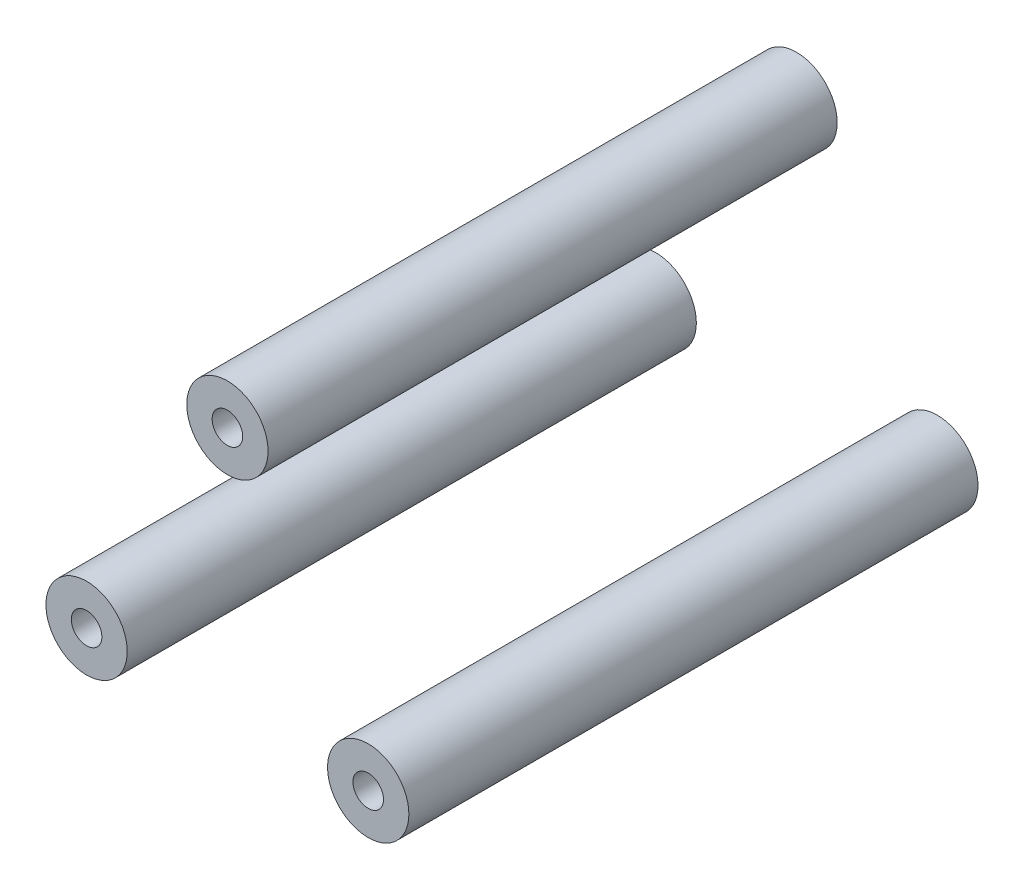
SolidWorks part; units mm, degrees
ref_plane "Front Plane" through (0, 0, 0) normal (0, 0, 1) x (1, 0, 0)
ref_plane "Top Plane" through (0, 0, 0) normal (0, 1, 0) x (1, 0, 0)
ref_plane "Right Plane" through (0, 0, 0) normal (1, 0, 0) x (0, 0, -1)
sketch "Sketch1" plane through (0, 0, 0) normal (0, 0, 1) x (1, 0, 0)
  line L0 (0, 0) -> (0, 25.4)
  line L1 (0, 0) -> (21.997, -12.7)
  line L2 (0, 0) -> (-21.997, -12.7)
  circle A0 centre (0, 25.4) radius 6.35
  circle A1 centre (0, 25.4) radius 2.3876
  circle A2 centre (-21.997, -12.7) radius 2.3876
  circle A3 centre (-21.997, -12.7) radius 6.35
  circle A4 centre (21.997, -12.7) radius 2.3876
  circle A5 centre (21.997, -12.7) radius 6.35
  dimension "D1" = 12.7
  dimension "D2" = 4.7752
  dimension "D3" = 120
  dimension "D4" = 120
  dimension "D5" = 25.4
sketch "Sketch2" plane through (0, 0, 0) normal (0, 0, 1) x (1, 0, 0)
  circle A0 centre (-21.997, -12.7) radius 6.35 construction
  circle A1 centre (21.997, -12.7) radius 6.35 construction
  circle A2 centre (21.997, -12.7) radius 2.3876 construction
  circle A3 centre (-21.997, -12.7) radius 2.3876 construction
  circle A4 centre (0, 25.4) radius 6.35 construction
  circle A5 centre (0, 25.4) radius 2.3876 construction
  circle A6 centre (-21.997, -12.7) radius 6.35
  circle A7 centre (21.997, -12.7) radius 6.35
  circle A8 centre (21.997, -12.7) radius 2.3876
  circle A9 centre (-21.997, -12.7) radius 2.3876
  circle A10 centre (0, 25.4) radius 6.35
  circle A11 centre (0, 25.4) radius 2.3876
extrude "Boss-Extrude1" add sketch "Sketch2" along normal blind 88.9
